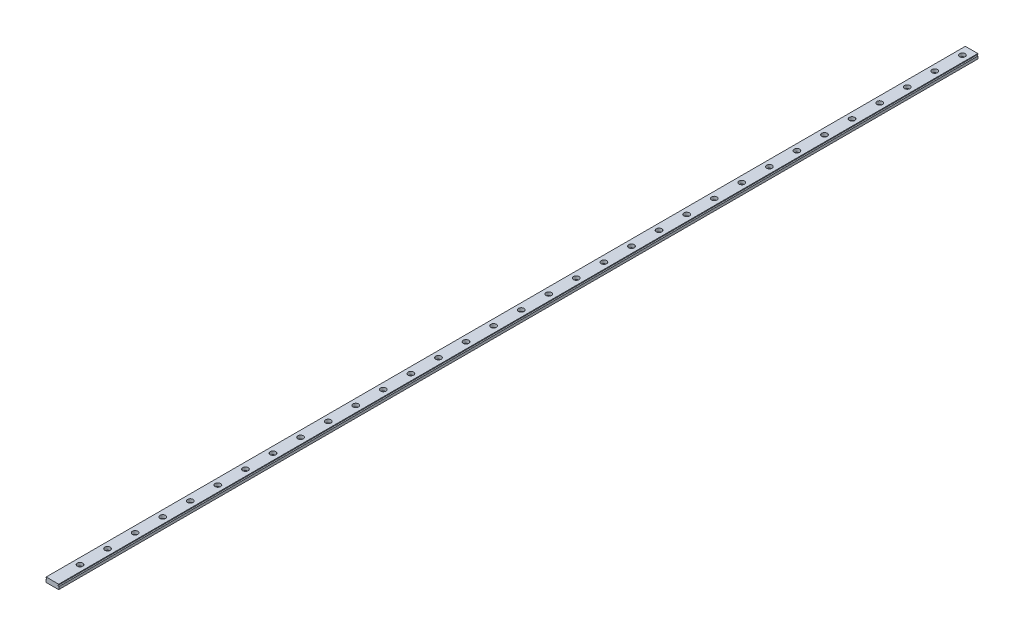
SolidWorks part; units mm, degrees
ref_plane "Front Plane" through (0, 0, 0) normal (0, 0, 1) x (1, 0, 0)
ref_plane "Top Plane" through (0, 0, 0) normal (0, 1, 0) x (1, 0, 0)
ref_plane "Right Plane" through (0, 0, 0) normal (1, 0, 0) x (0, 0, -1)
sketch "Sketch2" plane through (0, 0, 0) normal (0, 0, 1) x (1, 0, 0)
  line L0 (-7, 0.2886) -> (-7, -2.5114)
  line L1 (-7, -2.5114) -> (-6.8, -2.7114)
  line L2 (-6.8, -2.7114) -> (3.2, -2.7114)
  line L3 (3.8, -2.7114) -> (6.8, -2.7114)
  line L4 (6.8, -2.7114) -> (7, -2.5114)
  line L5 (7, -2.5114) -> (7, 0.2886)
  line L6 (7, 1.7886) -> (7, 2.2886)
  line L7 (7, 2.2886) -> (6.8, 2.4886)
  line L8 (6.8, 2.4886) -> (-6.8, 2.4886)
  line L9 (-6.8, 2.4886) -> (-7, 2.2886)
  line L10 (-7, 2.2886) -> (-7, 1.7886)
  line L11 (3.2, -2.7114) -> (3.8, -2.7114)
  arc A1 (6.25, 1.0386) -> (7, 0.2886) centre (7, 1.0386) ccw
  arc A2 (7, 1.7886) -> (6.25, 1.0386) centre (7, 1.0386) ccw
  arc A3 (-7, 0.2886) -> (-7, 1.7886) centre (-7, 1.0386) ccw
extrude "Boss-Extrude1" add sketch "Sketch2" along normal blind 1000
sketch "Sketch3" plane through (0, 2.4886, 0) normal (0, 1, 0) x (1, 0, 0)
  line L0 (7, -1000) -> (7, 0) construction
  line L1 (6.8, 0) -> (-6.8, 0) construction
  point P0 (0, -10)
  dimension "D1" = 7
  dimension "D2" = 10
hole_wizard "CBORE for M16 Hex Head Bolt1" positions "Sketch3" profile "Sketch4" counterbore size "M16" standard "DIN"
sketch "Sketch4" plane through (0, 2.4886, 10) normal (1, 0, 0) x (0, 0, 1)
  line L0 (0, 0) -> (0, 5.2)
  line L1 (0, 5.2) -> (1.75, 5.2)
  line L3 (1.75, 5.2) -> (1.75, 3.5)
  line L4 (1.75, 3.5) -> (3, 3.5)
  line L5 (3, 3.5) -> (3, 0)
  line L7 (3, 0) -> (0, 0)
  line L11 (0, -6.35) -> (0, 107.95) construction
  dimension "Thru Hole Dia." = 3.5
  dimension "Thru Hole Depth" = 5.2
  dimension "C'Bore Dia." = 6
  dimension "C'Bore Depth" = 3.5
other "Fill Pattern1" parameters "D5"=0, "D6"=0, "D1"=30, "D2"=60, "D3"=0, "D9"=33, "D7"=34, "D8"=2
